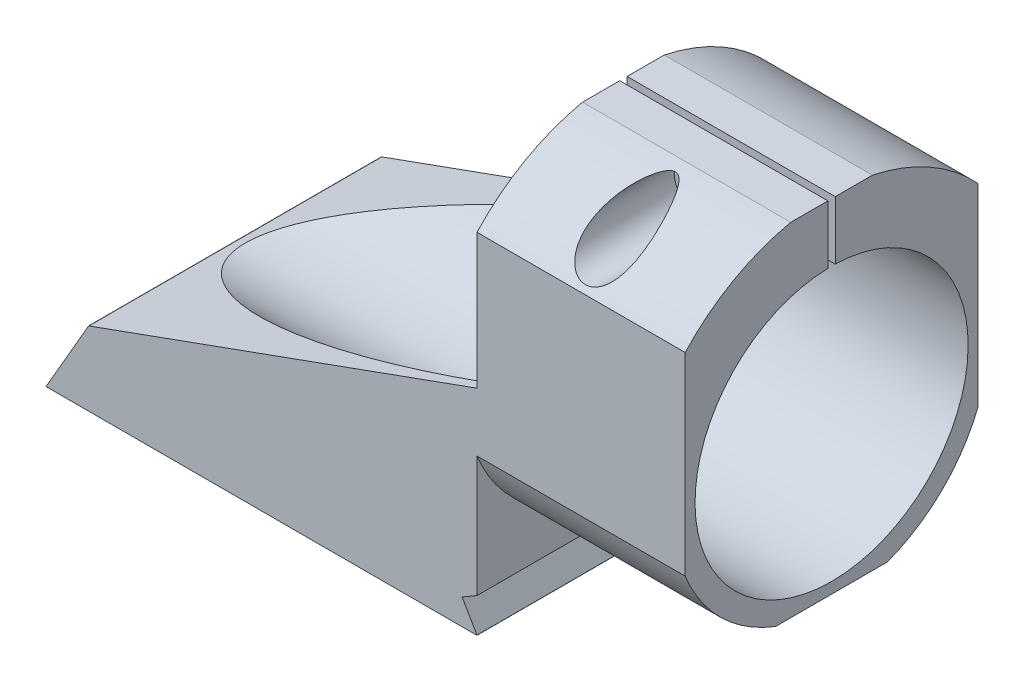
SolidWorks part; units mm, degrees
ref_plane "Front Plane" through (0, 0, 0) normal (0, 0, 1) x (1, 0, 0)
ref_plane "Top Plane" through (0, 0, 0) normal (0, 1, 0) x (1, 0, 0)
ref_plane "Right Plane" through (0, 0, 0) normal (1, 0, 0) x (0, 0, -1)
sketch "Sketch1" plane through (0, 0, 0) normal (0, 0, 1) x (1, 0, 0)
  line L0 (0, 0) -> (58.4454, 0)
  line L1 (0, 0) -> (5.4986, 9.525)
  line L2 (5.4986, 9.525) -> (58.4322, 9.525)
  line L3 (58.4322, 9.525) -> (58.4322, 4.6736)
  line L4 (58.4322, 4.6736) -> (56.4118, 3.4995)
  line L5 (56.4118, 3.4995) -> (58.4454, 0)
  dimension "D1" = 60.003
  dimension "D2" = 58.4454
  dimension "D3" = 52.9336
  dimension "D4" = 9.525
  dimension "D5" = 4.8514
  dimension "D6" = 2.3368
  dimension "D7" = 4.0475
extrude "Boss-Extrude1" add sketch "Sketch1" against normal blind 39.7002
sketch "Sketch6" plane through (0, 9.525, 0) normal (0, 1, 0) x (1, 0, 0)
  line L1 (5.4986, 39.7002) -> (58.4322, 39.7002)
  line L2 (5.4986, 39.7002) -> (5.4986, 0)
  line L3 (5.4986, 0) -> (58.4322, 0)
  line L4 (58.4322, 39.7002) -> (58.4322, 0)
extrude "Boss-Extrude5" add sketch "Sketch6" along normal blind 0.5
sketch "Sketch7" plane through (0, 10.025, 0) normal (0, 1, 0) x (1, 0, 0)
  line L1 (25.8186, 0) -> (77.6552, 0)
  line L2 (25.8186, 0) -> (25.8186, 39.7002)
  line L3 (25.8186, 39.7002) -> (77.6552, 39.7002)
  line L4 (77.6552, 0) -> (77.6552, 39.7002)
  line L7 (5.4986, 39.7002) -> (5.4986, 0) construction
  line L8 (58.4322, 0) -> (58.4322, 39.7002) construction
  dimension "D1" = 20.32
  dimension "D2" = 19.223
extrude "Boss-Extrude6" add sketch "Sketch7" along normal blind 39
sketch "Sketch22" plane through (25.8186, 0, 0) normal (-1, 0, 0) x (0, 0, 1)
  line L1 (-39.7002, 49.025) -> (0, 49.025)
  line L2 (-39.7002, 49.025) -> (-39.7002, 10.025)
  line L3 (-39.7002, 10.025) -> (0, 10.025)
  line L4 (0, 49.025) -> (0, 10.025)
extrude "Boss-Extrude8" add sketch "Sketch22" along normal blind 20
sketch "Sketch8" plane through (0, 0, 0) normal (0, 0, 1) x (1, 0, 0)
  line L0 (5.8186, 10.025) -> (5.8186, 49.025)
  line L1 (5.8186, 10.025) -> (58.4322, 29.025)
  line L2 (5.8186, 49.025) -> (58.4322, 49.025)
  line L5 (58.4322, 29.025) -> (58.4322, 49.025)
  line L6 (77.6552, 49.025) -> (77.6552, 10.025) construction
  dimension "D1" = 19.223
  dimension "D2" = 20
extrude "Cut-Extrude1" cut sketch "Sketch8" against normal through all
sketch "Sketch10" plane through (77.6552, 0, 0) normal (1, 0, 0) x (0, 0, -1)
  line L0 (19.8501, 10.025) -> (19.8501, 29.025)
  line L1 (0, 10.025) -> (39.7002, 10.025) construction
sketch "Sketch11" plane through (77.6552, 0, 0) normal (1, 0, 0) x (0, 0, -1)
  circle A0 centre (19.8501, 29.025) radius 18.5125
  dimension "D1" = 37.025
extrude "Cut-Extrude2" cut sketch "Sketch11" against normal through all
sketch "Sketch13" plane through (0, 0, 0) normal (0, 0, 1) x (1, 0, 0)
  line L0 (5.4986, 9.525) -> (5.7873, 10.025)
  line L1 (5.4986, 10.025) -> (5.8186, 10.025) construction
  line L2 (5.7873, 10.025) -> (5.4986, 10.025)
  line L3 (5.4986, 9.525) -> (5.4986, 10.025)
extrude "Cut-Extrude4" cut sketch "Sketch13" against normal through all
sketch "Sketch16" plane through (0, 49.025, 0) normal (0, 1, 0) x (1, 0, 0)
  line L1 (58.4322, 0) -> (77.6552, 0)
  line L2 (58.4322, 0) -> (58.4322, 39.7002)
  line L3 (58.4322, 39.7002) -> (77.6552, 39.7002)
  line L4 (77.6552, 0) -> (77.6552, 39.7002)
extrude "Boss-Extrude7" add sketch "Sketch16" along normal blind 1.0922
ref_plane "Plane1" [suppressed] through (118.6556, 0, 0) normal (1, 0, 0) x (0, 0, -1)
sketch "Sketch26" plane through (0, 50.1172, 0) normal (0, 1, 0) x (1, 0, 0)
  line L1 (58.4322, 0) -> (77.6552, 0)
  line L2 (58.4322, 0) -> (58.4322, 39.7002)
  line L3 (58.4322, 39.7002) -> (77.6552, 39.7002)
  line L4 (77.6552, 0) -> (77.6552, 39.7002)
extrude "Boss-Extrude12" add sketch "Sketch26" along normal blind 5.334
sketch "Sketch27" plane through (0, 10.025, 0) normal (0, -1, 0) x (1, 0, 0)
  line L1 (58.4322, 0) -> (77.6552, 0)
  line L2 (58.4322, 0) -> (58.4322, -39.7002)
  line L3 (58.4322, -39.7002) -> (77.6552, -39.7002)
  line L4 (77.6552, 0) -> (77.6552, -39.7002)
extrude "Boss-Extrude13" add sketch "Sketch27" along normal blind 1
sketch "Sketch31" plane through (0, 55.4512, 0) normal (0, 1, 0) x (1, 0, 0)
  line L0 (58.4322, 39.7002) -> (58.4322, 0) construction
  line L1 (77.6552, 19.3501) -> (58.4322, 19.3501)
  line L2 (77.6552, 19.3501) -> (77.6552, 20.3501)
  line L3 (77.6552, 20.3501) -> (58.4322, 20.3501)
  line L4 (58.4322, 19.3501) -> (58.4322, 20.3501)
  line L5 (77.6552, 19.3501) -> (58.4322, 20.3501) construction
  line L6 (77.6552, 20.3501) -> (58.4322, 19.3501) construction
  line L7 (77.6552, 39.7002) -> (58.4322, 39.7002) construction
  point P0 (68.0437, 19.8501)
  point P7 (68.0437, 39.7002)
  dimension "D1" = 19.8501
  dimension "D2" = 1
extrude "Cut-Extrude9" cut sketch "Sketch31" against normal up to next
surface "Surface-Extrude4" parameters "D1"=9
sketch "Sketch32" plane through (0, 0, 0) normal (0, 0, 1) x (1, 0, 0)
  line L1 (72.5437, 55.4512) -> (72.5437, 51.5142) construction
  line L2 (86.6552, 55.4512) -> (58.4322, 55.4512) construction
hole_wizard "CBORE for #6 Socket Head Cap Screw1" positions "Sketch59" profile "Sketch58" counterbore size "#6" standard "ANSI Inch"
sketch "Sketch59" plane through (0, 0, 0) normal (0, 0, 1) x (1, 0, 0)
  point P0 (72.5437, 51.5142)
sketch "Sketch58" plane through (72.5437, 51.5142, 0) normal (1, 0, 0) x (0, -1, 0)
  line L0 (0, 0) -> (0, 19.3501)
  line L1 (0, 19.3501) -> (1.8986, 19.3501)
  line L3 (1.8986, 19.3501) -> (1.8986, 16.2052)
  line L4 (1.8986, 16.2052) -> (3.5725, 16.2052)
  line L5 (3.5725, 16.2052) -> (3.5725, 0)
  line L7 (3.5725, 0) -> (0, 0)
  line L11 (0, -6.35) -> (0, 107.95) construction
  dimension "Thru Hole Dia." = 3.7973
  dimension "Thru Hole Depth" = 19.3501
  dimension "C'Bore Dia." = 7.145
  dimension "C'Bore Depth" = 16.2052
sketch "Sketch60" plane through (0, 0, -20.3501) normal (0, 0, 1) x (1, 0, 0)
  line L0 (72.5437, 51.5142) -> (72.5437, 55.4512) construction
  line L1 (86.6552, 55.4512) -> (58.4322, 55.4512) construction
  line L2 (72.5437, 55.4512) -> (72.5437, 51.5142) construction
hole_wizard "#6-32 Tapped Hole1" positions "Sketch62" profile "Sketch61" tap size "#6-32" standard "ANSI Inch"
sketch "Sketch62" plane through (0, 0, -20.3501) normal (0, 0, 1) x (1, 0, 0)
  point P0 (72.5437, 51.5142)
sketch "Sketch61" plane through (72.5437, 51.5142, -20.3501) normal (1, 0, 0) x (0, -1, 0)
  line L0 (0, 0) -> (0, 5.8127)
  line L1 (0, 5.8127) -> (1.3525, 5)
  line L2 (1.3525, 5) -> (1.3525, 0)
  line L5 (1.3525, 0) -> (0, 0)
  line L10 (0, 5.8127) -> (-1.3526, 5) construction
  line L11 (0, -6.35) -> (0, 107.95) construction
  dimension "Tap Drill Dia." = 2.7051
  dimension "Tap Drill Depth" = 5
  dimension "Drill Angle" = 118
sketch "Sketch74" plane through (86.6552, 0, 0) normal (1, 0, 0) x (0, 0, -1)
  line L2 (19.8501, 10.5125) -> (19.8501, 29.025) construction
  line L5 (19.8501, 10.025) -> (19.8501, 29.025) construction
  arc A1 (19.3501, 47.5308) -> (20.3501, 47.5308) centre (19.8501, 29.025) ccw construction
sketch "Sketch75" plane through (86.6552, 0, 0) normal (1, 0, 0) x (0, 0, -1)
  line L1 (0, 55.4512) -> (0, 9.025) construction
  line L2 (39.7002, 55.4512) -> (39.7002, 9.025) construction
  line L3 (0, 21.066) -> (0, 55.4512)
  line L4 (0, 55.4512) -> (39.7002, 55.4512)
  line L5 (39.7002, 55.4512) -> (39.7002, 21.066)
  arc A0 (0, 21.066) -> (39.7002, 21.066) centre (19.8501, 29.025) ccw
extrude "Cut-Extrude14" cut sketch "Sketch75" against normal up to surface (28.223 mm away) flip side to cut
sketch "Sketch77" plane through (0, 0, 0) normal (0, 0, 1) x (1, 0, 0)
  line L0 (72.5437, 55.0867) -> (86.6552, 55.0867)
  line L4 (86.6552, 55.4512) -> (86.6552, 21.066) construction
  circle A0 centre (72.5437, 51.5142) radius 3.5725 construction
sketch "Sketch76" plane through (86.6552, 0, 0) normal (1, 0, 0) x (0, 0, -1)
  circle A0 centre (19.8501, 29.025) radius 27
  dimension "D1" = 54
extrude "Cut-Extrude15" cut sketch "Sketch76" against normal up to surface (28.223 mm away) flip side to cut
